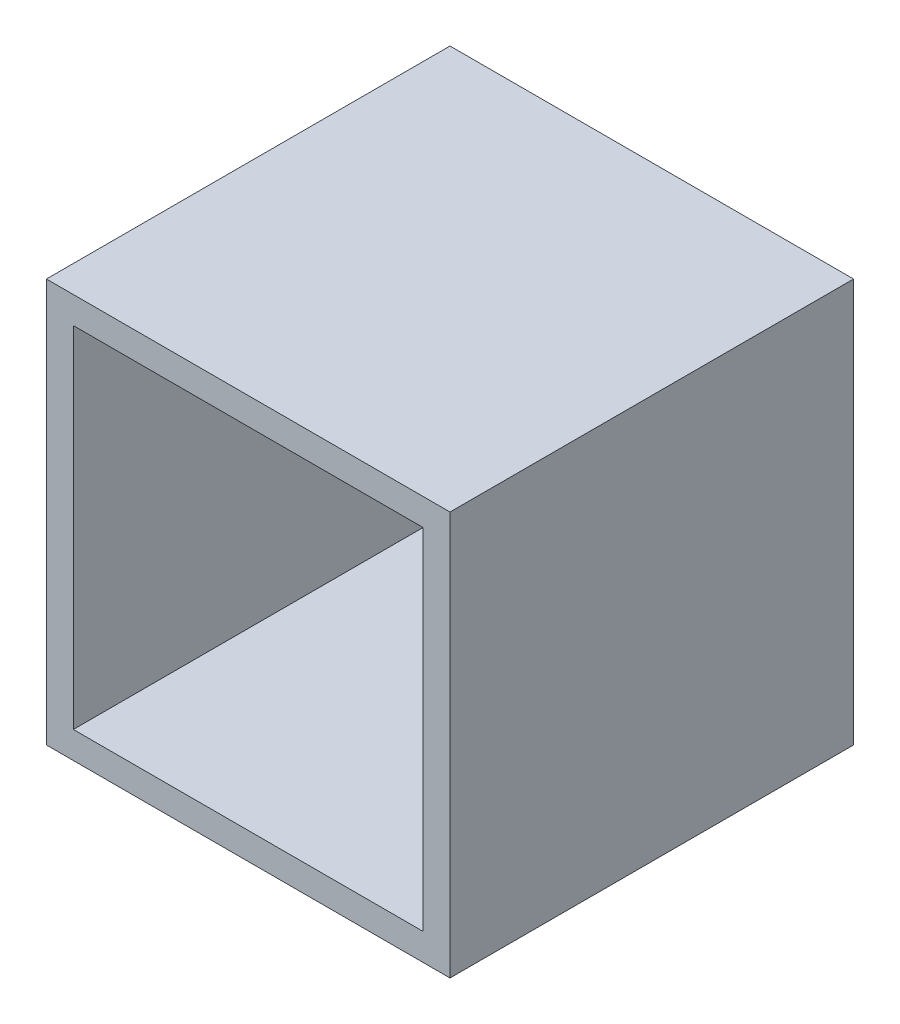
SolidWorks part; units mm, degrees
ref_plane "Plan de face" through (0, 0, 0) normal (0, 0, 1) x (1, 0, 0)
ref_plane "Plan de dessus" through (0, 0, 0) normal (0, 1, 0) x (1, 0, 0)
ref_plane "Plan de droite" through (0, 0, 0) normal (1, 0, 0) x (0, 0, -1)
body saved out of another part "Stock-cabinet base part-1"
